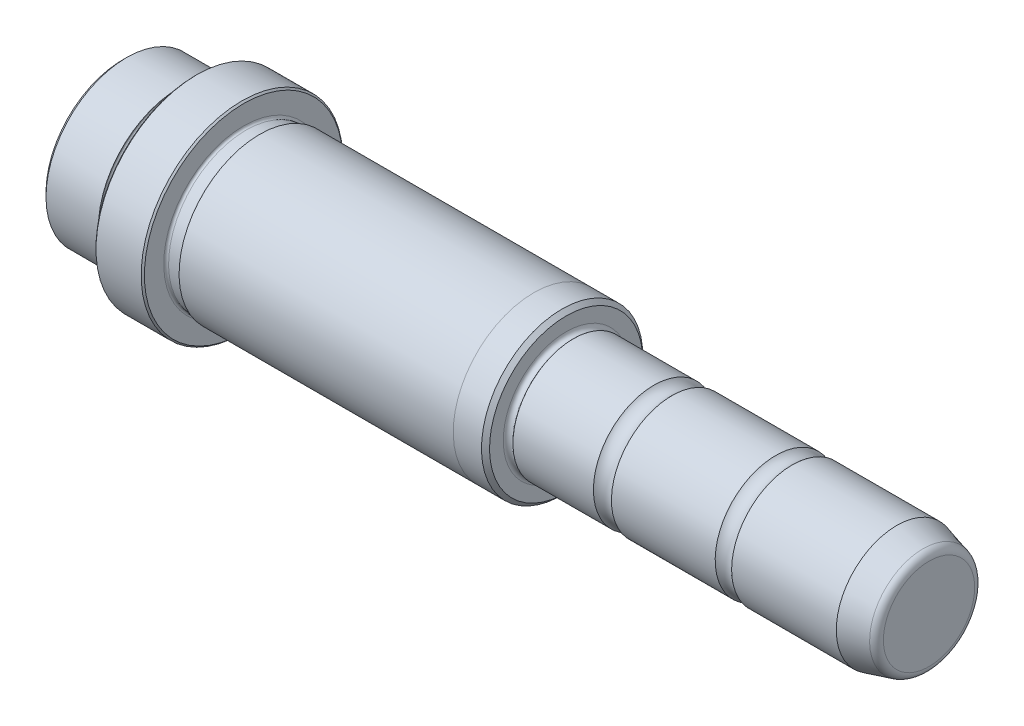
SolidWorks part; units mm, degrees
ref_plane "Front Plane" through (0, 0, 0) normal (0, 0, 1) x (1, 0, 0)
ref_plane "Top Plane" through (0, 0, 0) normal (0, 1, 0) x (1, 0, 0)
ref_plane "Right Plane" through (0, 0, 0) normal (1, 0, 0) x (0, 0, -1)
sketch "Sketch1" plane through (0, 0, 0) normal (0, 0, 1) x (1, 0, 0)
  line L0 (45, 6.4282) -> (41, 7.5)
  line L1 (41, 7.5) -> (0.9, 7.5)
  line L2 (0, 7.8) -> (0, 10)
  line L3 (0, 10) -> (-4, 10)
  line L4 (-38, 10.0001) -> (-38, 9.9)
  line L5 (-38.3, 9.6) -> (-39.7, 9.6)
  line L6 (-40, 9.9) -> (-40, 12.5)
  line L7 (-40, 12.5) -> (-46, 12.5)
  line L8 (-46, 12.5) -> (-46, 9.9)
  line L9 (-46.3, 9.6) -> (-47.7, 9.6)
  line L10 (-48, 9.9) -> (-48, 10)
  line L11 (-48, 10) -> (-55, 10)
  line L12 (-55, 10) -> (-55, 0)
  line L13 (45, 6.4282) -> (45, 0)
  line L14 (45, 0) -> (-45, 0) construction
  line L15 (45, 0) -> (-55, 0)
  line L16 (-4, 10.0001) -> (-38, 10.0001)
  line L17 (-4, 10.0001) -> (-4, 10)
  arc A0 (0, 7.8) -> (0.9, 7.5) centre (0.5, 7.8) ccw
  arc A1 (-46, 9.9) -> (-46.3, 9.6) centre (-46.3, 9.9) cw
  arc A2 (-47.7, 9.6) -> (-48, 9.9) centre (-47.7, 9.9) cw
  arc A3 (-39.7, 9.6) -> (-40, 9.9) centre (-39.7, 9.9) cw
  arc A4 (-38, 9.9) -> (-38.3, 9.6) centre (-38.3, 9.9) cw
  point P16 (0, 0)
  point P28 (-40, 9.6)
  point P31 (-38, 9.6)
  dimension "ShoulderRadii" = 1
  dimension "D5" = 0.3
  dimension "D1" = 15
  dimension "D2" = 0.4
  dimension "PinDia" = 15
  dimension "ChamferLeadIn" = 4
  dimension "ShoulderDia" = 20
  dimension "PinLengthN" = 45
  dimension "ShoulderLength" = 46
  dimension "D3" = 0.0001
  dimension "ShoulderGap" = 2
  dimension "D4" = 4
  dimension "T" = 6
  dimension "CollarLength" = 9
  dimension "HeadDia" = 25
  dimension "D8" = 0.2
revolve "Revolve1" add sketch "Sketch1" angle 360 about L14
sketch "Sketch2" plane through (0, 0, 0) normal (0, 0, 1) x (1, 0, 0)
  line L0 (45, -6.4282) -> (45, 6.4282) construction
  line L1 (145.9417, 7.1) -> (148.0583, 7.1) construction
  line L2 (41, 7.5) -> (0.9, 7.5) construction
  line L4 (25.9802, 7.5) -> (28.0198, 7.5)
  arc A0 (25.9802, 7.5) -> (28.0198, 7.5) centre (27, 8.6) ccw
  dimension "GrooveRadius" = 1.5
  dimension "D3" = 0.4
  dimension "AGroove" = 18
revolve "Groove A" cut sketch "Sketch2" angle 360 about axis through (45, 0, 0) along (1, 0, 0)
sketch "Sketch3" plane through (0, 0, 0) normal (0, 0, 1) x (1, 0, 0)
  line L0 (25.9802, 7.5) -> (0.9, 7.5) construction
  line L3 (10.882, 7.5) -> (13.118, 7.5)
  arc A0 (10.882, 7.5) -> (13.118, 7.5) centre (12, 8.5) ccw
  arc A1 (25.9802, 7.5) -> (28.0198, 7.5) centre (27, 8.6) ccw construction
  dimension "D1" = 0.5
  dimension "GroovePitch" = 15
revolve "Groove B" cut sketch "Sketch3" angle 360 about axis through (45, 0, 0) along (1, 0, 0)
sketch "Sketch4" plane through (0, 0, 0) normal (0, 0, 1) x (1, 0, 0)
  line L2 (10.882, 7.5) -> (0.9, 7.5) construction
  line L3 (-4.0198, 7.5) -> (-1.9802, 7.5)
  arc A0 (-4.0198, 7.5) -> (-1.9802, 7.5) centre (-3, 8.6) ccw
  arc A3 (10.882, 7.5) -> (13.118, 7.5) centre (12, 8.5) ccw construction
  dimension "D1" = 0.4
revolve "Groove C" [suppressed] cut sketch "Sketch4" angle 360
sketch "Sketch5" [suppressed] plane through (0, 0, 0) normal (0, 0, 1) x (1, 0, 0)
  line L0 (21.9802, 7.5) -> (24.0198, 7.5)
  line L1 (59.9802, 7.5) -> (0.9, 7.5) construction
  arc A0 (21.9802, 7.5) -> (24.0198, 7.5) centre (23, 8.6) ccw
  arc A3 (59.9802, 7.5) -> (62.0198, 7.5) centre (61, 8.6) ccw construction
  dimension "D1" = 0.4
revolve "Groove D" [suppressed] cut sketch "Sketch5" angle 360
fillet "Fillet1" radius 1 1 edges at (45, 6.4282, 0)
chamfer "Chamfer1" distance 0.2 angle 45 2 edges at (-46, 12.5, 0) (-40, 12.5, 0)
chamfer "Chamfer2" distance 0.5 angle 45 2 edges at (-55, 10, 0) (0, 10, 0)
